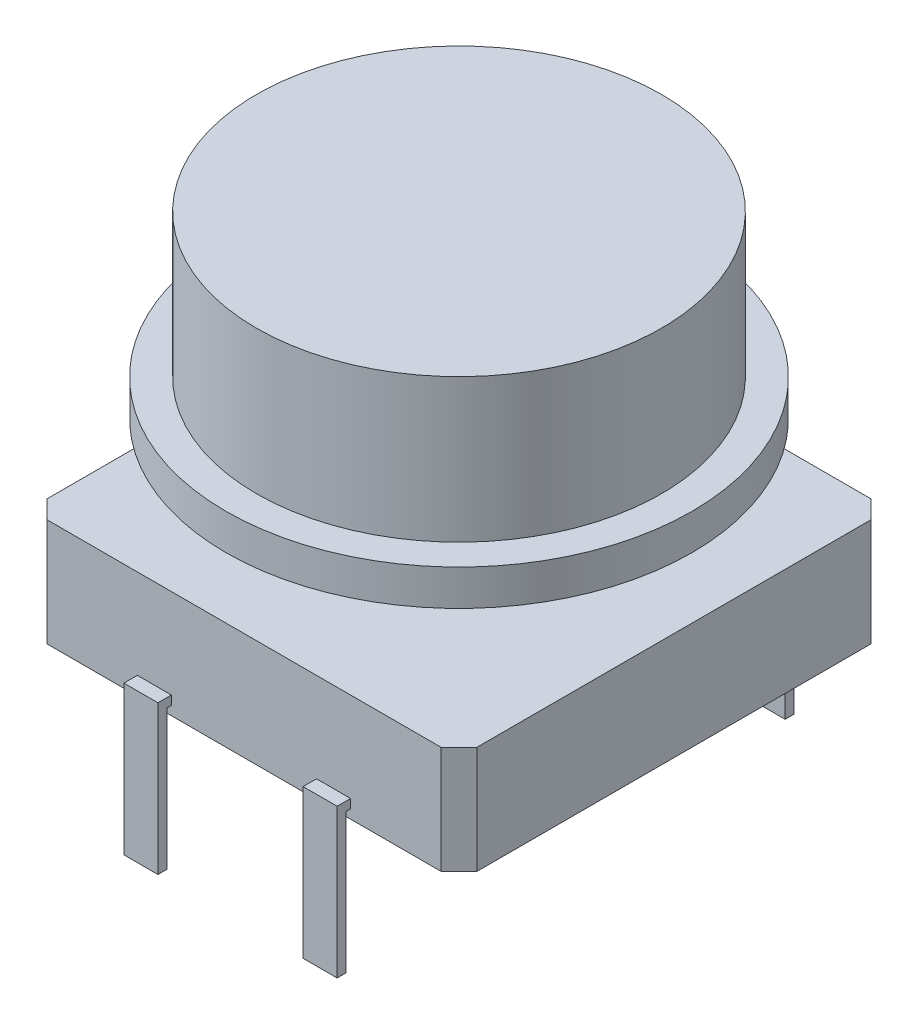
SolidWorks part; units mm, degrees
other "Markup1"
sketch "Sketch13" plane through (-6.5, 10.2, -6.5) normal (-0.9979, 0.0018, -0.0647) x (-0.0647, 0.0089, 0.9979)
sketch "Sketch14" plane through (-6.5, 10.2, -6.5) normal (-0.9979, 0.0018, -0.0647) x (-0.0647, 0.0089, 0.9979)
ref_plane "Front Plane" through (0, 0, 0) normal (0, 0, 1) x (1, 0, 0)
ref_plane "Top Plane" through (0, 0, 0) normal (0, 1, 0) x (1, 0, 0)
ref_plane "Right Plane" through (0, 0, 0) normal (1, 0, 0) x (0, 0, -1)
sketch "Sketch1" plane through (0, 0, 0) normal (0, 1, 0) x (1, 0, 0)
  line L0 (-5.5, 6) -> (-6, 5.5)
  line L1 (-5.5, 6) -> (5.5, 6)
  line L2 (-6, 5.5) -> (-6, -5.5)
  line L3 (-5.5, -6) -> (5.5, -6)
  line L4 (6, 5.5) -> (6, -5.5)
  line L5 (-6, 6) -> (6, -6) construction
  line L6 (-6, -6) -> (6, 6) construction
  line L7 (5.5, 6) -> (6, 5.5)
  line L8 (5.5, -6) -> (6, -5.5)
  line L9 (-6, -5.5) -> (-5.5, -6)
  point P0 (0, 0)
  dimension "D1" = 12
  dimension "D2" = 12
extrude "Boss-Extrude1" add sketch "Sketch1" along normal blind 3
sketch "Sketch2" plane through (0, 3, 0) normal (0, 1, 0) x (1, 0, 0)
  circle A0 centre (0, 0) radius 3.375
  dimension "D1" = 6.75
extrude "Boss-Extrude2" add sketch "Sketch2" along normal blind 0.2
sketch "Sketch3" plane through (0, 3.2, 0) normal (0, 1, 0) x (1, 0, 0)
  line L1 (-1.75, 1.75) -> (1.75, 1.75)
  line L2 (-1.75, 1.75) -> (-1.75, -1.75)
  line L3 (-1.75, -1.75) -> (1.75, -1.75)
  line L4 (1.75, 1.75) -> (1.75, -1.75)
  line L5 (-1.75, 1.75) -> (1.75, -1.75) construction
  line L6 (-1.75, -1.75) -> (1.75, 1.75) construction
  point P0 (0, 0)
  dimension "D1" = 3.5
  dimension "D2" = 3.5
extrude "Boss-Extrude3" add sketch "Sketch3" along normal blind 2
sketch "Sketch4" plane through (0, 5.2, 0) normal (0, 1, 0) x (1, 0, 0)
  circle A0 centre (0, 0) radius 6.5
  dimension "D1" = 13
extrude "Boss-Extrude4" add sketch "Sketch4" along normal blind 1
sketch "Sketch5" plane through (0, 6.2, 0) normal (0, 1, 0) x (1, 0, 0)
  circle A0 centre (0, 0) radius 5.65
  dimension "D1" = 11.3
extrude "Boss-Extrude5" add sketch "Sketch5" along normal blind 4
ref_plane "Plane1" through (-2.975, 0, 0) normal (-1, 0, 0) x (0, 0, 1)
sketch "Sketch7" plane through (-2.975, 0, 0) normal (-1, 0, 0) x (0, 0, 1)
  line L1 (6, 3) -> (6, 0) construction
  line L7 (6.375, 0.5) -> (6, 0.5)
  line L9 (-5.5, 3) -> (5.5, 3) construction
  line L17 (0, -2.34) -> (0, 11.1182) construction
  line L18 (6, 0.5) -> (6, 0.25)
  line L23 (6.1875, 0.5) -> (6.1875, -2.75) construction
  line L24 (6, 0.25) -> (6.125, 0.25)
  line L28 (6.125, 0.25) -> (6.125, -3.65)
  line L29 (6.375, 0.5) -> (6.375, -3.65)
  line L30 (6.375, -3.65) -> (6.125, -3.65)
  dimension "D1" = 2.5
  dimension "D2" = 0.375
  dimension "D6" = 0.25
extrude "Boss-Extrude6" add sketch "Sketch7" against normal blind 0.95
ref_plane "Plane2" through (0, 0, 0) normal (-1, 0, 0) x (0, 0, 1)
mirror "Mirror1" about plane through (0, 0, 0) normal (-1, 0, 0) of "Boss-Extrude6"
ref_plane "Plane3" through (0, 0, 0) normal (0, 0, 1) x (1, 0, 0)
mirror "Mirror2" about plane through (0, 0, 0) normal (0, 0, 1) of "Mirror1", "Boss-Extrude6"
